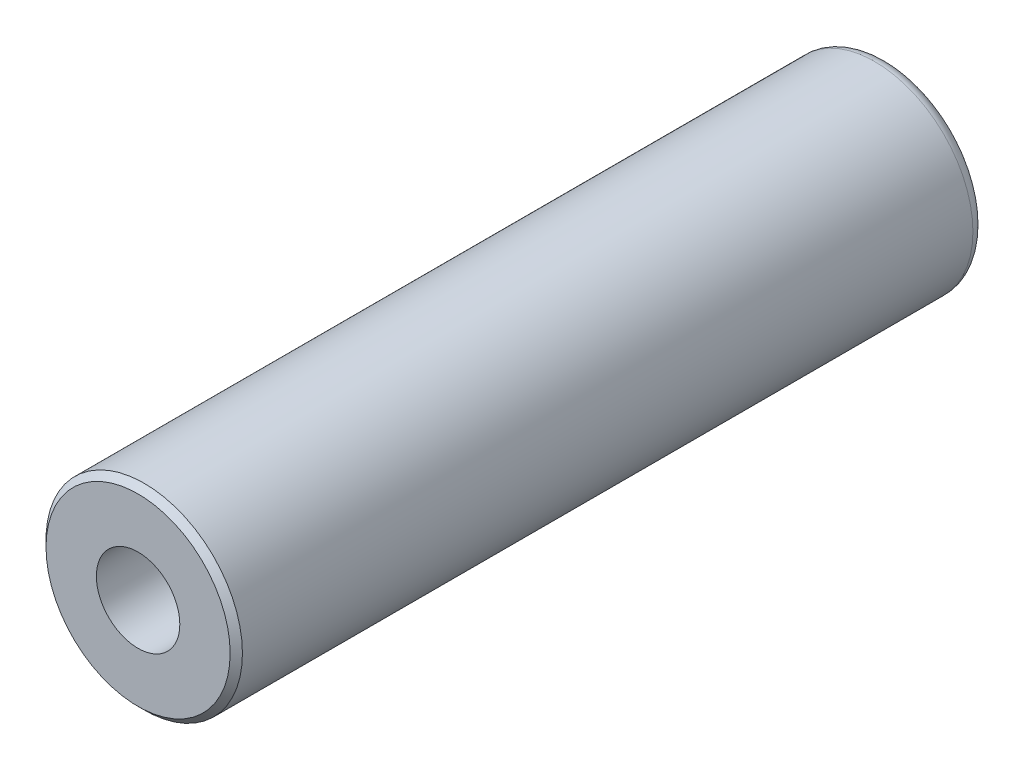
SolidWorks part; units mm, degrees
ref_plane "Plan1" through (0, 0, 0) normal (0, 0, 1) x (1, 0, 0)
ref_plane "Plan2" through (0, 0, 0) normal (0, 1, 0) x (1, 0, 0)
ref_plane "Plan3" through (0, 0, 0) normal (1, 0, 0) x (0, 0, -1)
sketch "Esquisse1" plane through (0, 0, 0) normal (0, 0, 1) x (1, 0, 0)
  circle A0 centre (0, 0) radius 8
  dimension "D1" = 16
extrude "Base-Extrusion" add sketch "Esquisse1" along normal blind 61
fillet "Congé1" radius 1
chamfer "Chanfrein1" distance 0.5 angle 45
hole_wizard "Perçage1" positions "Esquisse3" profile "Esquisse2" tap size "M8x1.25" standard "ISO"
sketch "Esquisse3" plane through (0, 0, 61) normal (0, 0, 1) x (1, 0, 0)
  point P0 (0, 0)
sketch "Esquisse2" plane through (0, 0, 61) normal (1, 0, 0) x (0, -1, 0)
  line L0 (0, 0) -> (0, 22.0429)
  line L1 (0, 22.0429) -> (3.4, 20)
  line L2 (3.4, 20) -> (3.4, 0)
  line L5 (3.4, 0) -> (0, 0)
  line L10 (0, 22.0429) -> (-3.4, 20) construction
  line L11 (0, -6.35) -> (0, 107.95) construction
  dimension "Diamètre du perçage" = 6.8
  dimension "Profondeur du perçage" = 20
  dimension "Angle de pointe" = 118
